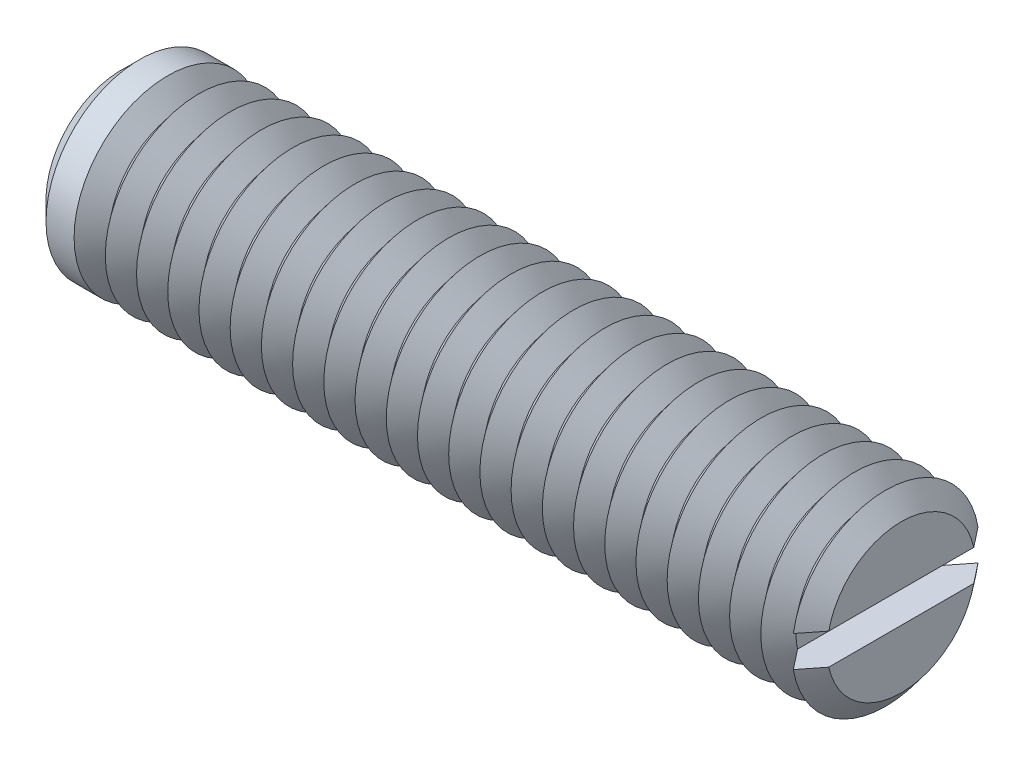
SolidWorks part; units mm, degrees
ref_plane "Front Plane" through (0, 0, 0) normal (0, 0, 1) x (1, 0, 0)
ref_plane "Top Plane" through (0, 0, 0) normal (0, 1, 0) x (1, 0, 0)
ref_plane "Right Plane" through (0, 0, 0) normal (1, 0, 0) x (0, 0, -1)
sketch "Sketch1" plane through (0, 0, 0) normal (1, 0, 0) x (0, 0, -1)
  circle A0 centre (0, 0) radius 3
  dimension "D1" = 6
extrude "Extrude1" add sketch "Sketch1" along normal mid plane 25
sketch "Sketch2" plane through (0, 0, 0) normal (0, 0, 1) x (1, 0, 0)
  line L0 (12.5, 0.5) -> (11.5, 0.5)
  line L1 (12.5, -3) -> (12.5, 3) construction
  line L2 (11.5, 0.5) -> (11.5, -0.5)
  line L3 (0, 0) -> (50000, 0) construction
  line L4 (12.5, -0.5) -> (11.5, -0.5)
  line L5 (12.5, -0.5) -> (12.5, 0.5)
  point P9 (11.5, 0)
  dimension "D1" = 1
extrude "Extrude2" cut sketch "Sketch2" against normal mid plane 9
chamfer "Chamfer1" distance 0.6 angle 45 1 edges at (-12.5, 0, -3)
sketch "Sketch3" plane through (0, 0, 0) normal (0, 0, 1) x (1, 0, 0)
  line L0 (0, 0) -> (30.9602, 0) construction
  line L1 (12, -3) -> (13, -3)
  line L2 (-11.9, -3) -> (12.5, -3) construction
  line L3 (13, -3) -> (12.5, -2.3755)
  line L4 (12.5, -3) -> (12.5, -0.5) construction
  line L5 (12.5, -2.3755) -> (12, -3)
  dimension "D1" = 1
  dimension "D2" = 0.8
revolve "Cut-Revolve1" cut sketch "Sketch3" angle 360 about L0
pattern_linear "LPattern1" count 24 spacing 1 along (-1, 0, 0) of "Cut-Revolve1"
equation "\"D2@Sketch3\" = \"D1@Sketch3\"*0.8"
